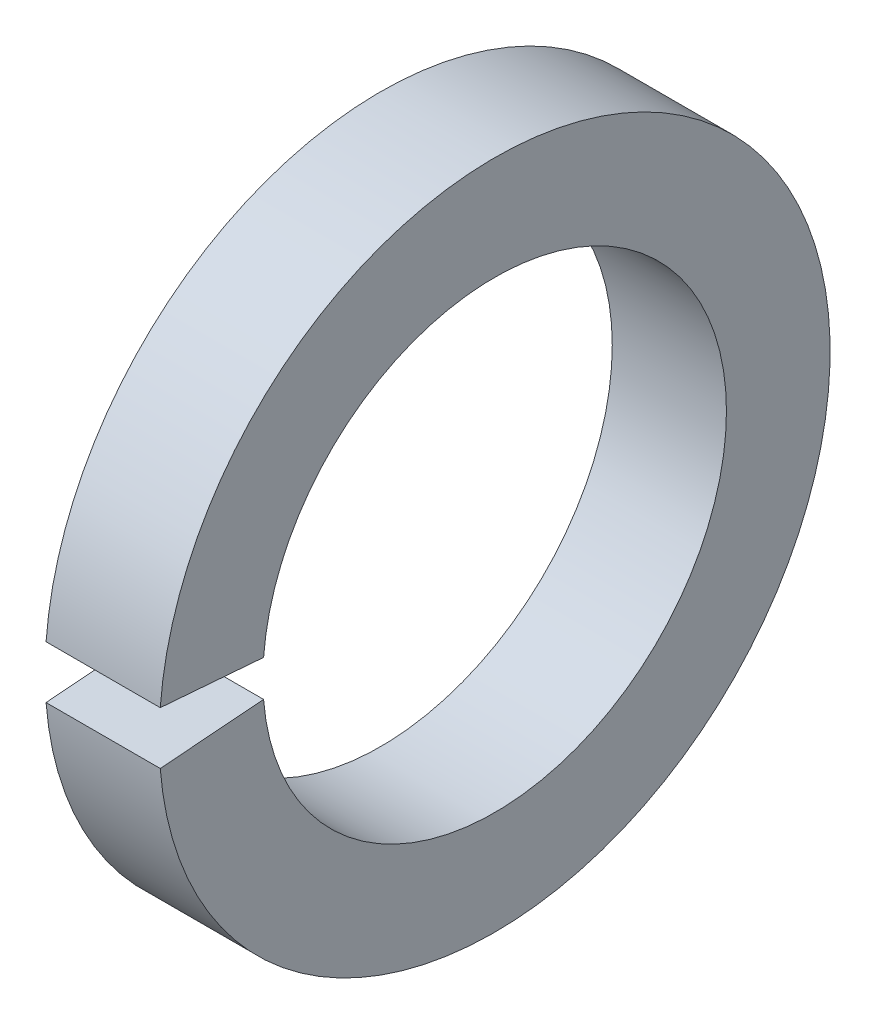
SolidWorks part; units mm, degrees
ref_plane "Plane1" through (0, 0, 0) normal (0, 0, 1) x (1, 0, 0)
ref_plane "Plane2" through (0, 0, 0) normal (0, 1, 0) x (1, 0, 0)
ref_plane "Plane3" through (0, 0, 0) normal (1, 0, 0) x (0, 0, -1)
sketch "Sketch1" plane through (0, 0, 0) normal (0, 0, 1) x (1, 0, 0)
  line L0 (-34.925, 0) -> (9.525, 0) construction
  line L1 (0, 12.8905) -> (0, 18.6563)
  line L2 (0, 18.6563) -> (-6.35, 18.6563)
  line L3 (-6.35, 18.6563) -> (-6.35, 12.8905)
  line L4 (-6.35, 12.8905) -> (0, 12.8905)
  dimension "Thickness" = 6.35
  dimension "Inside_dia" = 25.781
  dimension "Outside_dia" = 37.3126
revolve "Base-Revolve" add sketch "Sketch1" angle 360 about L0
sketch "Sketch2" plane through (0, 0, 0) normal (-1, 0, 0) x (0, -1, 0)
  line L0 (0, 0) -> (1.493, 18.9708)
  line L1 (0, -3.175) -> (0, 12.7) construction
  line L2 (0, 0) -> (-1.493, 18.9708)
  arc A0 (1.493, 18.9708) -> (-1.493, 18.9708) centre (0, 0) ccw
  dimension "D1" = 19.0294
  dimension "Gap_ang" = 9
extrude "Gap" cut sketch "Sketch2" along normal through all
equation "\"D1@Sketch2\" = \"Outside_dia@Sketch1\" * 0.51"
